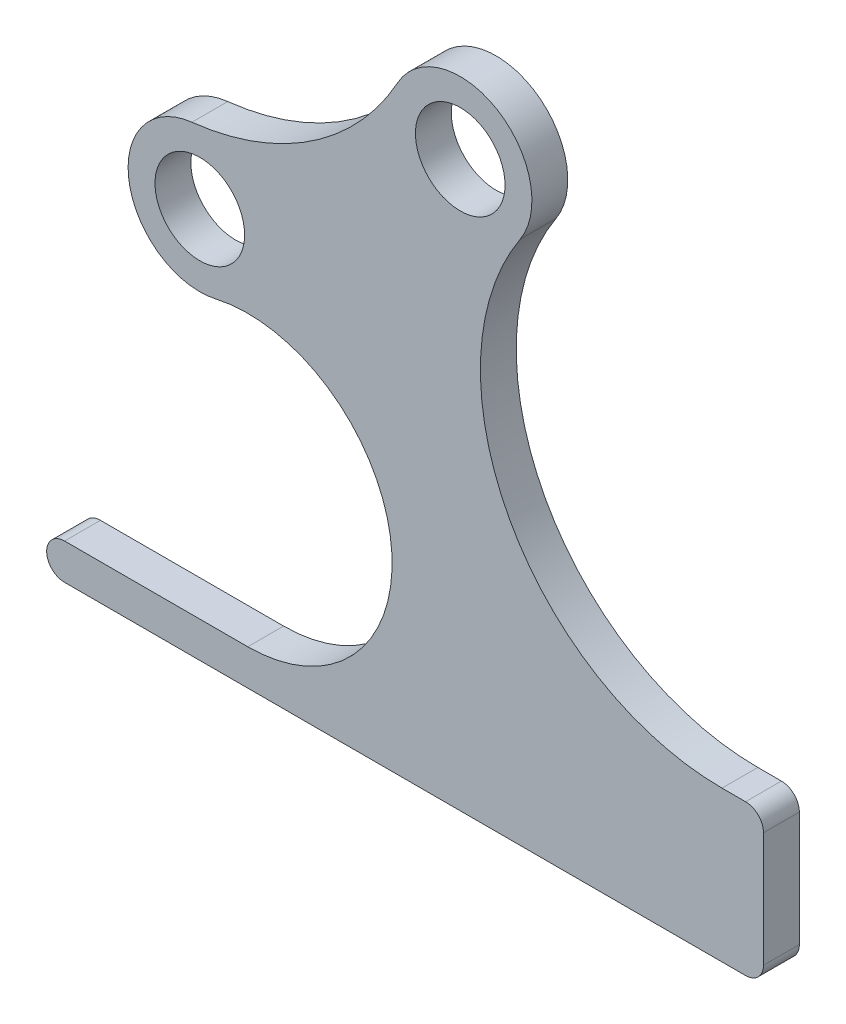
SolidWorks part; units mm, degrees
ref_plane "Plan de face" through (0, 0, 0) normal (0, 0, 1) x (1, 0, 0)
ref_plane "Plan de dessus" through (0, 0, 0) normal (0, 1, 0) x (1, 0, 0)
ref_plane "Plan de droite" through (0, 0, 0) normal (1, 0, 0) x (0, 0, -1)
sketch "Esquisse1" plane through (0, 0, 0) normal (0, 0, 1) x (1, 0, 0)
  line L0 (0, 0) -> (-126.0913, 0)
  line L1 (-126.0913, 10) -> (-74.9888, 10)
  line L2 (57.3337, 42) -> (63.9087, 42)
  line L3 (68.9087, 37) -> (68.9087, 5)
  line L4 (63.9087, 0) -> (0, 0)
  line L5 (-52.4916, 141.5057) -> (-37.365, 109.0668) construction
  line L6 (-37.365, 109.0668) -> (-6.0913, 42) construction
  line L7 (-88.365, 109.0668) -> (-37.365, 109.0668) construction
  arc A0 (-126.0913, 0) -> (-126.0913, 10) centre (-126.0913, 5) cw
  arc A1 (-74.9888, 10) -> (-83.9274, 89.5653) centre (-74.9888, 50.2847) ccw
  arc A2 (-83.9274, 89.5653) -> (-90.5605, 128.9459) centre (-88.365, 109.0668) cw
  arc A3 (-90.5605, 128.9459) -> (-33.1959, 167.1337) centre (-98.7934, 203.4927) ccw
  arc A4 (-33.1959, 167.1337) -> (1.0077, 146.4496) centre (-15.7033, 157.4379) cw
  arc A5 (1.0077, 146.4496) -> (57.3337, 42) centre (57.3337, 109.4121) ccw
  arc A6 (68.9087, 5) -> (63.9087, 0) centre (63.9087, 5) cw
  arc A7 (63.9087, 42) -> (68.9087, 37) centre (63.9087, 37) cw
  circle A8 centre (-15.7033, 157.4379) radius 12.5
  circle A9 centre (-88.365, 109.0668) radius 12.5
  arc A10 (-4.9771, 151.0193) -> (-27.6344, 161.1659) centre (-37.365, 109.0668) ccw construction
  circle A11 centre (-24.2639, 80.9712) radius 19 construction
  arc A12 (-86.8332, 121.4726) -> (-86.8332, 96.661) centre (-37.365, 109.0668) ccw construction
  dimension "D3" = 5
  dimension "D5" = 25
  dimension "D6" = 20
  dimension "D7" = 20
  dimension "D8" = 25
  dimension "D9" = 75
  dimension "D10" = 53
  dimension "D11" = 51
  dimension "D13" = 38
  dimension "D1" = 195
  dimension "D2" = 10
  dimension "D4" = 42
  dimension "D12" = 65
  dimension "D14" = 42
  dimension "D15" = 43
  dimension "D16" = 74
  dimension "D17" = 75
extrude "Boss.-Extru.1" add sketch "Esquisse1" along normal blind 10
